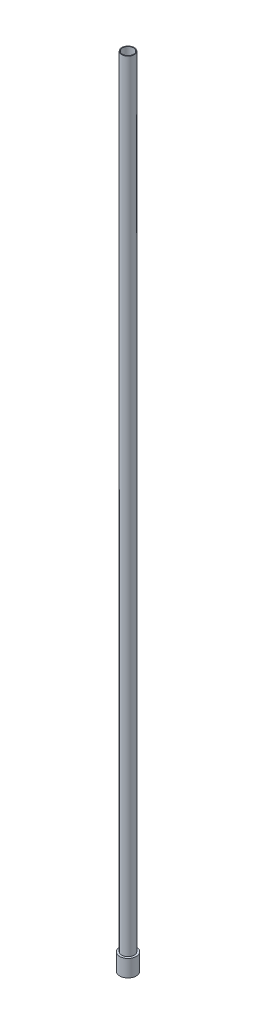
SolidWorks part; units mm, degrees
ref_plane "Front Plane" through (0, 0, 0) normal (0, 0, 1) x (1, 0, 0)
ref_plane "Top Plane" through (0, 0, 0) normal (0, 1, 0) x (1, 0, 0)
ref_plane "Right Plane" through (0, 0, 0) normal (1, 0, 0) x (0, 0, -1)
sketch "Sketch2" plane through (0, 0, 0) normal (0, 0, 1) x (1, 0, 0)
  line L0 (0, 0) -> (0, 304.8) construction
  line L1 (-2.1209, 0) -> (-3.175, 0)
  line L2 (-3.175, 0) -> (-3.175, 6.477)
  line L3 (-3.175, 6.477) -> (-2.3749, 6.477)
  line L4 (-2.3749, 6.477) -> (-2.3749, 304.8)
  line L5 (-2.3749, 304.8) -> (-2.1209, 304.8)
  line L6 (-2.1209, 0) -> (-2.1209, 304.8)
  dimension "D1" = 6.477
  dimension "D2" = 6.35
  dimension "D3" = 4.7498
  dimension "D4" = 304.8
  dimension "D5" = 4.2418
revolve "Revolve1" add sketch "Sketch2" angle 360 about L0
